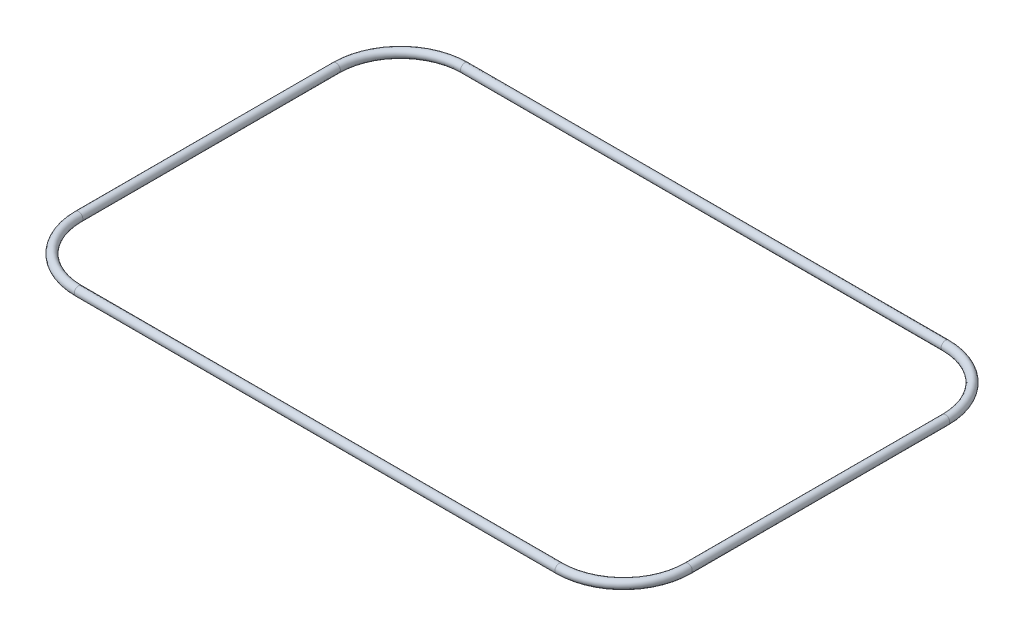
SolidWorks part; units mm, degrees
ref_plane "Front Plane" through (0, 0, 0) normal (0, 0, 1) x (1, 0, 0)
ref_plane "Top Plane" through (0, 0, 0) normal (0, 1, 0) x (1, 0, 0)
ref_plane "Right Plane" through (0, 0, 0) normal (1, 0, 0) x (0, 0, -1)
sketch "Sketch1" plane through (0, 0, 0) normal (0, 1, 0) x (1, 0, 0)
  line L1 (-44.4487, -35.72) -> (44.4488, -35.72)
  line L2 (-56.355, -23.8138) -> (-56.355, 23.8138)
  line L3 (-44.4487, 35.72) -> (44.4487, 35.72)
  line L4 (56.355, -23.8138) -> (56.355, 23.8138)
  line L5 (-56.355, -35.72) -> (56.355, 35.72) construction
  line L6 (-56.355, 35.72) -> (56.355, -35.72) construction
  arc A0 (44.4487, 35.72) -> (56.355, 23.8138) centre (44.4487, 23.8138) cw
  arc A1 (44.4488, -35.72) -> (56.355, -23.8138) centre (44.4488, -23.8138) ccw
  arc A2 (-44.4487, -35.72) -> (-56.355, -23.8138) centre (-44.4487, -23.8138) cw
  arc A3 (-56.355, 23.8138) -> (-44.4487, 35.72) centre (-44.4487, 23.8138) cw
  point P0 (0, 0)
  dimension "D1" = 11.9062
  dimension "D2" = 112.71
  dimension "D3" = 71.44
sweep "Sweep1" add path "Sketch1" parameters "D3"=1.5875
